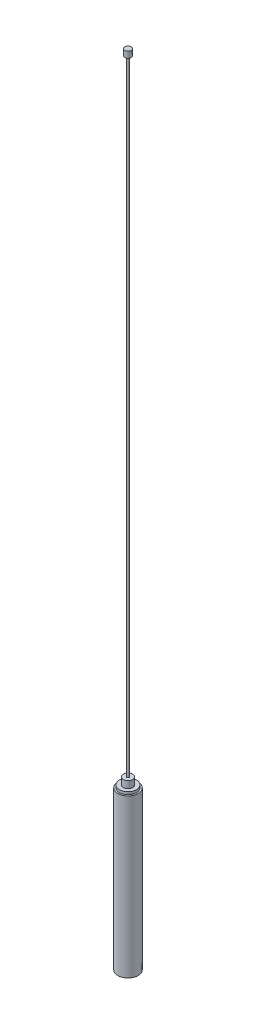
SolidWorks part; units mm, degrees
ref_plane "Alzado" through (0, 0, 0) normal (0, 0, 1) x (1, 0, 0)
ref_plane "Planta" through (0, 0, 0) normal (0, 1, 0) x (1, 0, 0)
ref_plane "Vista lateral" through (0, 0, 0) normal (1, 0, 0) x (0, 0, -1)
sketch "Croquis1" plane through (0, 0, 0) normal (0, 1, 0) x (1, 0, 0)
  circle A0 centre (0, 0) radius 16
extrude "Saliente-Extruir1" add sketch "Croquis1" along normal blind 250
sketch "Croquis2" plane through (0, 250, 0) normal (0, 1, 0) x (1, 0, 0)
  circle A0 centre (0, 0) radius 13.5
extrude "Saliente-Extruir2" add sketch "Croquis2" along normal blind 4
sketch "Croquis3" plane through (0, 254, 0) normal (0, 1, 0) x (1, 0, 0)
  circle A0 centre (0, 0) radius 7.5347
extrude "Saliente-Extruir3" add sketch "Croquis3" along normal blind 11
sketch "Croquis4" plane through (0, 0, 0) normal (0, -1, 0) x (1, 0, 0)
  circle A0 centre (0, 0) radius 14.2259
extrude "Cortar-Extruir1" cut sketch "Croquis4" against normal blind 248
sketch "Croquis5" plane through (0, 265, 0) normal (0, 1, 0) x (1, 0, 0)
  circle A0 centre (0, 0) radius 1.752
extrude "Cortar-Extruir2" cut sketch "Croquis5" against normal blind 248
ref_plane "Plano1" through (0, 1, 0) normal (0, 1, 0) x (1, 0, 0)
sketch "Croquis6" plane through (0, 1, 0) normal (0, 1, 0) x (1, 0, 0)
  circle A0 centre (0, 0) radius 14.1799
extrude "Saliente-Extruir4" add sketch "Croquis6" along normal blind 4 separate body
sketch "Croquis7" plane through (0, 265, 0) normal (0, 1, 0) x (1, 0, 0)
  circle A0 centre (0, 0) radius 1.5
extrude "Saliente-Extruir5" add sketch "Croquis7" along normal blind 1000 separate body
sketch "Croquis8" plane through (0, 1265, 0) normal (0, 1, 0) x (1, 0, 0)
  circle A0 centre (0, 0) radius 5
extrude "Saliente-Extruir6" add sketch "Croquis8" against normal blind 10
